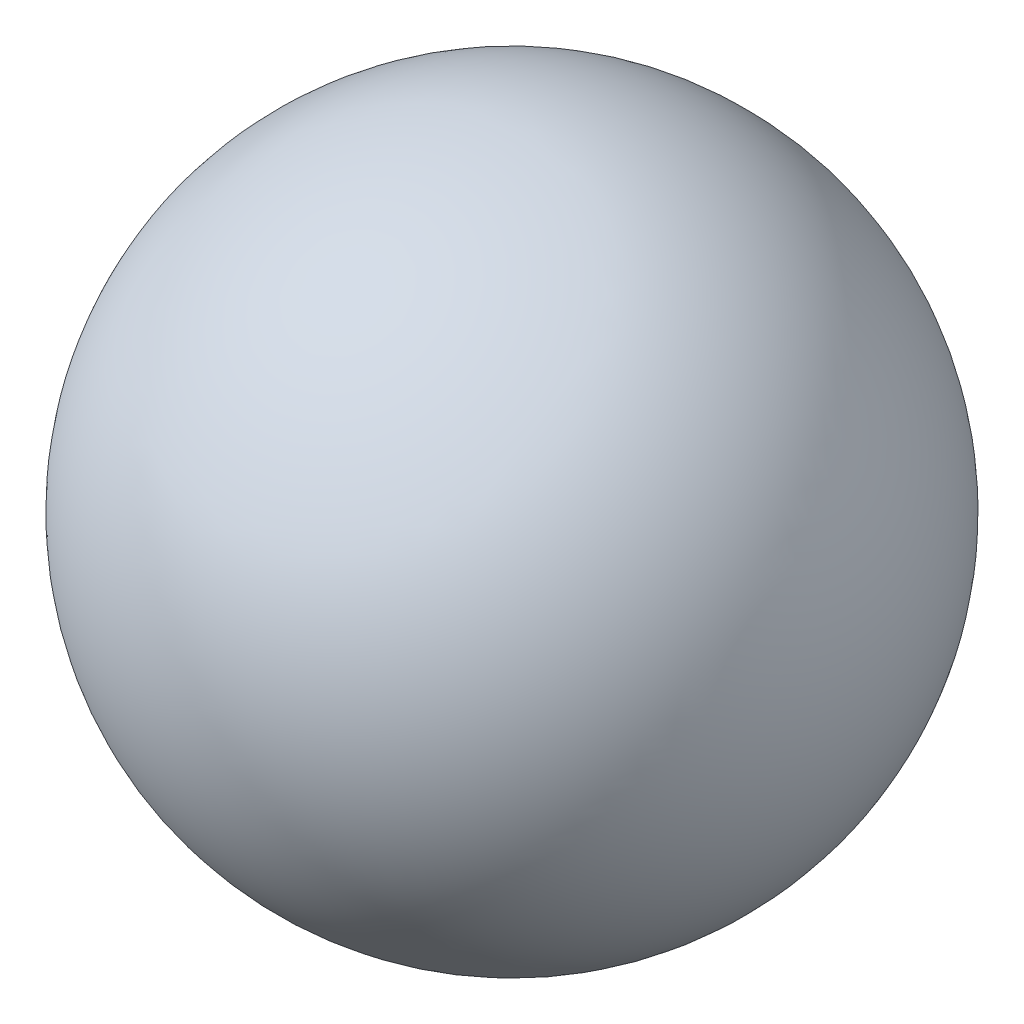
SolidWorks part; units mm, degrees
ref_plane "Front Plane" through (0, 0, 0) normal (0, 0, 1) x (1, 0, 0)
ref_plane "Top Plane" through (0, 0, 0) normal (0, 1, 0) x (1, 0, 0)
ref_plane "Right Plane" through (0, 0, 0) normal (1, 0, 0) x (0, 0, -1)
sketch "Sketch2" plane through (0, 0, 0) normal (0, 0, 1) x (1, 0, 0)
  line L0 (-19.05, 19.05) -> (19.05, 19.05)
  arc A0 (-19.05, 19.05) -> (19.05, 19.05) centre (0, 19.05) cw
revolve "Revolve1" add sketch "Sketch2" angle 360 about L0
